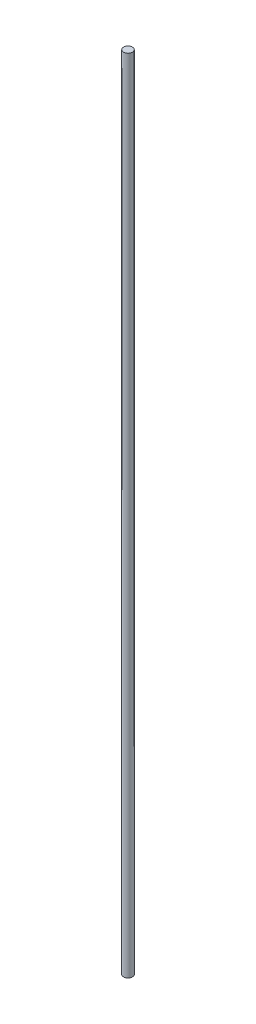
SolidWorks part; units mm, degrees
ref_plane "Ebene vorne" through (0, 0, 0) normal (0, 0, 1) x (1, 0, 0)
ref_plane "Ebene oben" through (0, 0, 0) normal (0, 1, 0) x (1, 0, 0)
ref_plane "Ebene rechts" through (0, 0, 0) normal (1, 0, 0) x (0, 0, -1)
sketch "Skizze1" plane through (0, 0, 0) normal (0, 1, 0) x (1, 0, 0)
  circle A0 centre (0, 0) radius 4
extrude "Aufsatz-Linear austragen1" add sketch "Skizze1" along normal blind 720
